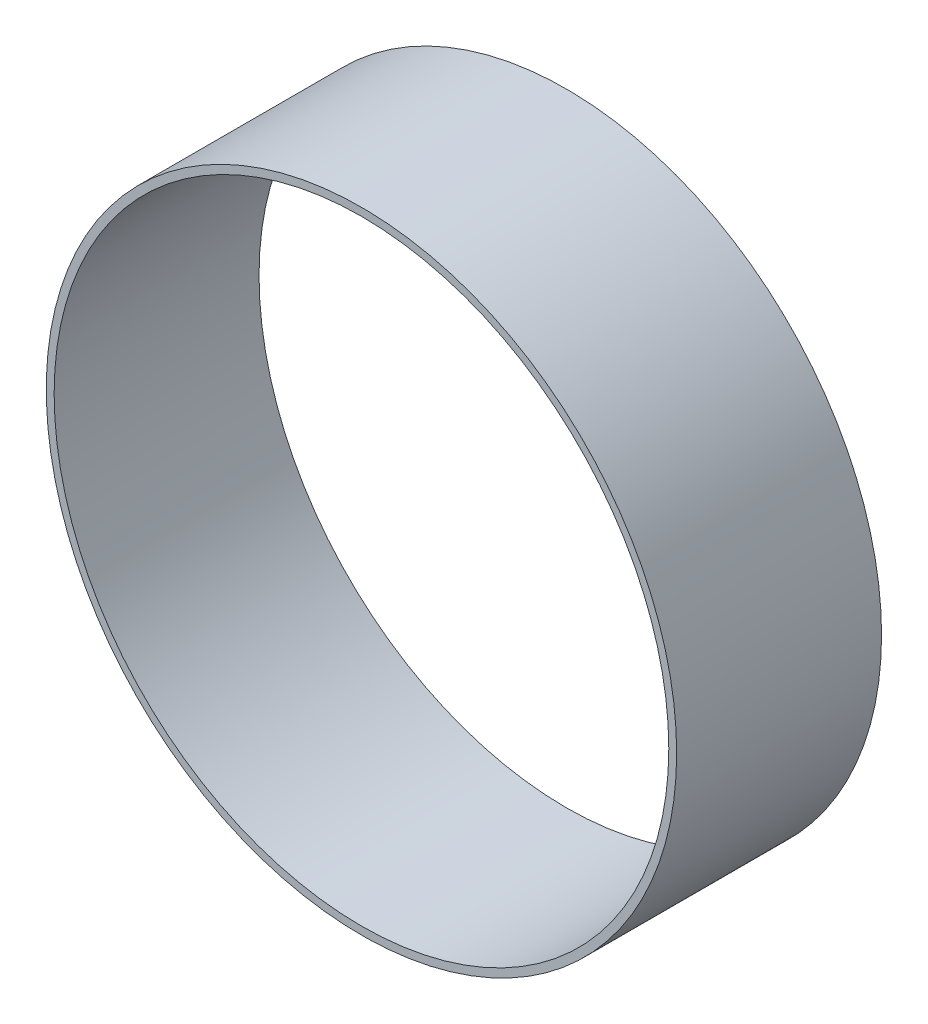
SolidWorks part; units mm, degrees
ref_plane "Front" through (0, 0, 0) normal (0, 0, 1) x (1, 0, 0)
ref_plane "Top" through (0, 0, 0) normal (0, 1, 0) x (1, 0, 0)
ref_plane "Right" through (0, 0, 0) normal (1, 0, 0) x (0, 0, -1)
sketch "Sketch1" plane through (0, 0, 0) normal (0, 0, 1) x (1, 0, 0)
  circle A0 centre (0, 0) radius 127
  circle A1 centre (0, 0) radius 123.825
  dimension "D1" = 254
  dimension "D2" = 3.175
extrude "Boss-Extrude1" add sketch "Sketch1" along normal blind 82.55
